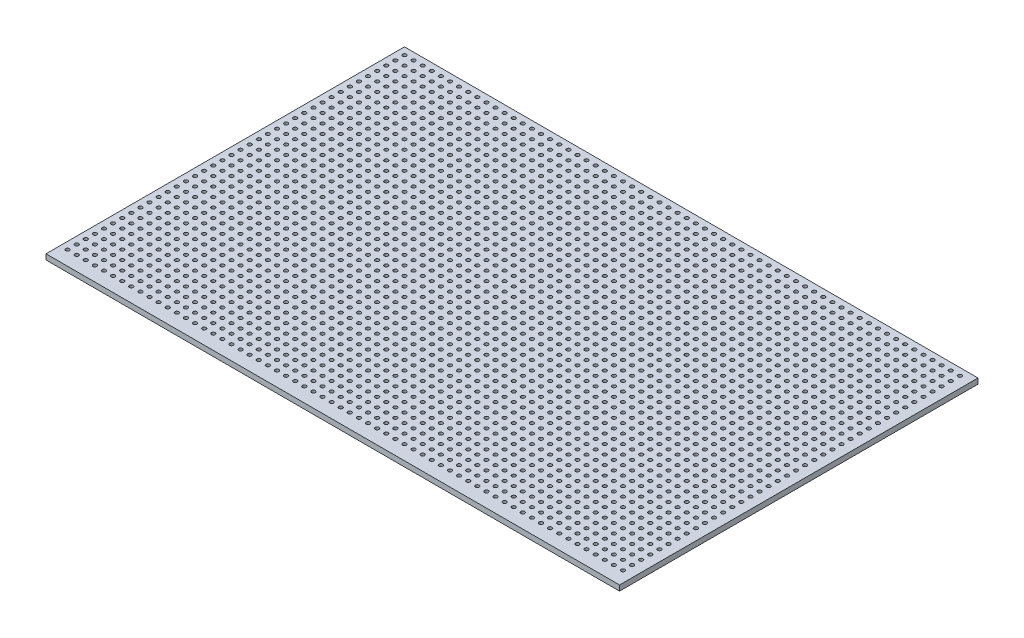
SolidWorks part; units mm, degrees
ref_plane "Front Plane" through (0, 0, 0) normal (0, 0, 1) x (1, 0, 0)
ref_plane "Top Plane" through (0, 0, 0) normal (0, 1, 0) x (1, 0, 0)
ref_plane "Right Plane" through (0, 0, 0) normal (1, 0, 0) x (0, 0, -1)
sketch "Sketch1" plane through (0, 0, 0) normal (0, 1, 0) x (1, 0, 0)
  line L1 (-80, 50) -> (80, 50)
  line L2 (-80, 50) -> (-80, -50)
  line L3 (-80, -50) -> (80, -50)
  line L4 (80, 50) -> (80, -50)
  line L5 (-80, 50) -> (80, -50) construction
  line L6 (-80, -50) -> (80, 50) construction
  point P0 (0, 0)
extrude "Extrude1" add sketch "Sketch1" along normal blind 1.5
hole_wizard "Ø1.05 (1.05) Diameter Hole1" positions "3DSketch1" profile "Sketch2" hole size "Ø1.05" standard "ISO"
sketch3d "3DSketch1"
  point P0 (-78, 1.5, -48)
sketch "Sketch2" plane through (-78, 1.5, -48) normal (1, 0, 0) x (0, 0, 1)
  line L0 (0, 0) -> (0, 1.5)
  line L1 (0, 1.5) -> (0.525, 1.5)
  line L2 (0.525, 1.5) -> (0.525, 0)
  line L5 (0.525, 0) -> (0, 0)
  line L11 (0, -6.35) -> (0, 107.95) construction
  dimension "Thru Hole Dia." = 1.05
  dimension "Thru Hole Depth" = 1.5
other "Fill Pattern1" parameters "D1"=2.54, "D2"=90, "D3"=1
